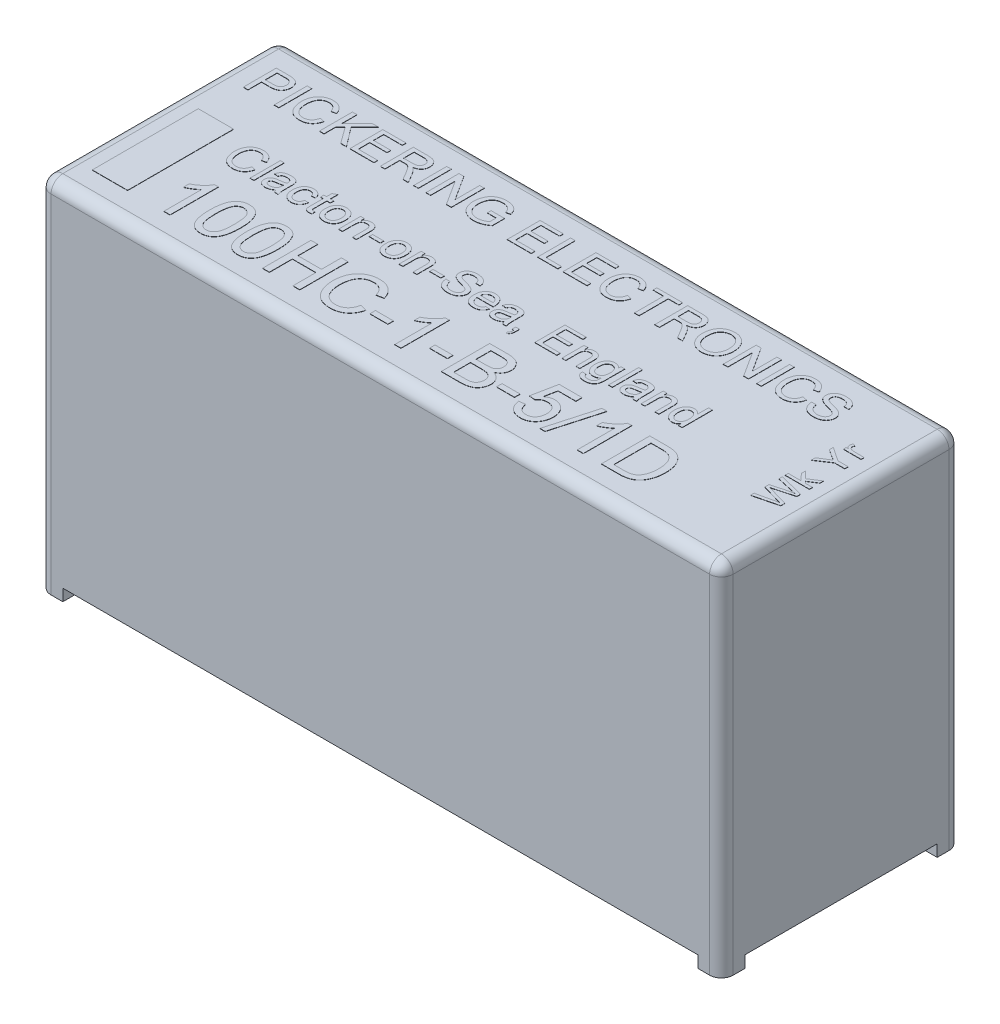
SolidWorks part; units mm, degrees
ref_plane "Front Plane" through (0, 0, 0) normal (0, 0, 1) x (1, 0, 0)
ref_plane "Top Plane" through (0, 0, 0) normal (0, 1, 0) x (1, 0, 0)
ref_plane "Right Plane" through (0, 0, 0) normal (1, 0, 0) x (0, 0, -1)
sketch "Sketch1" plane through (0, 0, 0) normal (0, 1, 0) x (1, 0, 0)
  line L1 (-14.478, -5.08) -> (14.478, -5.08)
  line L2 (-14.478, -5.08) -> (-14.478, 5.08)
  line L3 (-14.478, 5.08) -> (14.478, 5.08)
  line L4 (14.478, -5.08) -> (14.478, 5.08)
  line L5 (-14.478, -5.08) -> (14.478, 5.08) construction
  line L6 (-14.478, 5.08) -> (14.478, -5.08) construction
  point P0 (0, 0)
  dimension "D1" = 28.956
  dimension "D2" = 10.16
extrude "Boss-Extrude1" add sketch "Sketch1" along normal blind 15.24
sketch "Sketch2" plane through (0, 0, 5.08) normal (0, 0, 1) x (1, 0, 0)
  line L0 (-14.478, 0) -> (14.478, 0) construction
  line L1 (-13.478, 0) -> (13.478, 0)
  line L2 (-13.478, 0) -> (-13.478, 0.5)
  line L3 (-13.478, 0.5) -> (13.478, 0.5)
  line L4 (13.478, 0) -> (13.478, 0.5)
  line L5 (-14.478, 15.24) -> (-14.478, 0) construction
  line L6 (14.478, 15.24) -> (14.478, 0) construction
  dimension "D1" = 1
  dimension "D2" = 1
  dimension "D3" = 0.5
extrude "Cut-Extrude1" cut sketch "Sketch2" against normal through all
sketch "Sketch3" plane through (14.478, 0, 0) normal (1, 0, 0) x (0, 0, -1)
  line L0 (-5.08, 0) -> (5.08, 0) construction
  line L1 (-4.08, 0) -> (4.08, 0)
  line L2 (-4.08, 0) -> (-4.08, 0.5)
  line L3 (-4.08, 0.5) -> (4.08, 0.5)
  line L4 (4.08, 0) -> (4.08, 0.5)
  line L5 (-5.08, 15.24) -> (-5.08, 0) construction
  line L6 (5.08, 15.24) -> (5.08, 0) construction
  dimension "D1" = 1
  dimension "D2" = 1
  dimension "D3" = 0.5
extrude "Cut-Extrude2" cut sketch "Sketch3" against normal through all
sketch "Sketch4" plane through (0, 0.5, 0) normal (0, -1, 0) x (1, 0, 0)
  line L0 (-14.478, 0) -> (14.478, 0) construction
  line L1 (-14.478, -4.08) -> (-14.478, 4.08) construction
  line L2 (14.478, -4.08) -> (14.478, 4.08) construction
  line L4 (13.478, 5.08) -> (-13.478, 5.08) construction
  line L5 (0, 5.08) -> (0, -5.08) construction
  line L6 (13.478, -5.08) -> (-13.478, -5.08) construction
  line L7 (-2.8, -0.125) -> (-2.3, -0.125)
  line L8 (-2.8, -0.125) -> (-2.8, 0.125)
  line L9 (-2.8, 0.125) -> (-2.3, 0.125)
  line L10 (-2.3, -0.125) -> (-2.3, 0.125)
  line L11 (-2.8, -0.125) -> (-2.3, 0.125) construction
  line L12 (-2.8, 0.125) -> (-2.3, -0.125) construction
  line L13 (-7.9, -0.125) -> (-7.4, -0.125)
  line L14 (-7.9, -0.125) -> (-7.9, 0.125)
  line L15 (-7.9, 0.125) -> (-7.4, 0.125)
  line L16 (-7.4, -0.125) -> (-7.4, 0.125)
  line L17 (-7.9, -0.125) -> (-7.4, 0.125) construction
  line L18 (-7.9, 0.125) -> (-7.4, -0.125) construction
  line L19 (2.3, -0.125) -> (2.8, -0.125)
  line L20 (2.3, -0.125) -> (2.3, 0.125)
  line L21 (2.3, 0.125) -> (2.8, 0.125)
  line L22 (2.8, -0.125) -> (2.8, 0.125)
  line L23 (2.3, -0.125) -> (2.8, 0.125) construction
  line L24 (2.3, 0.125) -> (2.8, -0.125) construction
  line L25 (7.4, -0.125) -> (7.9, -0.125)
  line L26 (7.4, -0.125) -> (7.4, 0.125)
  line L27 (7.4, 0.125) -> (7.9, 0.125)
  line L28 (7.9, -0.125) -> (7.9, 0.125)
  line L29 (7.4, -0.125) -> (7.9, 0.125) construction
  line L30 (7.4, 0.125) -> (7.9, -0.125) construction
  point P6 (-2.55, 0)
  point P17 (-7.65, 0)
  point P22 (2.55, 0)
  point P27 (7.65, 0)
  dimension "D1" = 5.1
  dimension "D2" = 5.1
  dimension "D3" = 5.1
  dimension "D4" = 0.5
  dimension "D5" = 0.25
extrude "Boss-Extrude2" add sketch "Sketch4" along normal blind 3.6854 separate body
fillet "Fillet2" radius 0.5 4 edges at (0, 15.24, 5.08) (-14.478, 15.24, 0) (0, 15.24, -5.08) (14.478, 15.24, 0)
fillet "Fillet3" radius 0.5 8 edges at (-14.3316, 15.0936, -4.9336) (14.3316, 15.0936, -4.9336) (14.3316, 15.0936, 4.9336) (-14.3316, 15.0936, 4.9336) (-14.478, 7.37, -5.08) (14.478, 7.37, -5.08) (14.478, 7.37, 5.08) (-14.478, 7.37, 5.08)
sketch "Sketch5" plane through (0, 15.24, 0) normal (0, 1, 0) x (1, 0, 0)
  line L0 (-13.478, 2.42) -> (10.7486, 2.42) construction
  line L1 (-11.228, -0.78) -> (8.6555, -0.78) construction
  line L2 (-11.228, -3.83) -> (12.0348, -3.83) construction
  line L3 (13.978, -5.08) -> (-13.978, -5.08) construction
  line L4 (-13.478, 0.67) -> (-11.978, 0.67)
  line L5 (-13.478, 0.67) -> (-13.478, -3.83)
  line L6 (-13.478, -3.83) -> (-11.978, -3.83)
  line L7 (-11.978, 0.67) -> (-11.978, -3.83)
  line L8 (-14.478, -4.58) -> (-14.478, 4.58) construction
  line L9 (13.478, -1.83) -> (13.478, 2.742) construction
  line L10 (14.478, 4.58) -> (14.478, -4.58) construction
  text T0 "PICKERING ELECTRONICS" font "Arial" height 1.4
  text T1 "Clacton-on-Sea, England" font "Arial" height in points 5
  text T2 "100HC-1-B-5/1D" font "Arial" height in points 8
  text T3 "Wk Yr" font "Arial" height in points 4
  dimension "D1" = 4.5
  dimension "D2" = 1.5
  dimension "D3" = 1.25
  dimension "D4" = 1
  dimension "D5" = 1.25
  dimension "D6" = 4.3
  dimension "D7" = 7.5
  dimension "D8" = 3.25
  dimension "D9" = 3.25
  dimension "D10" = 3.25
  dimension "D11" = 1
extrude "Print Details" add sketch "Sketch5" along normal blind 0.01 separate body
equation "\"1.251.20mm\"=1.2"
